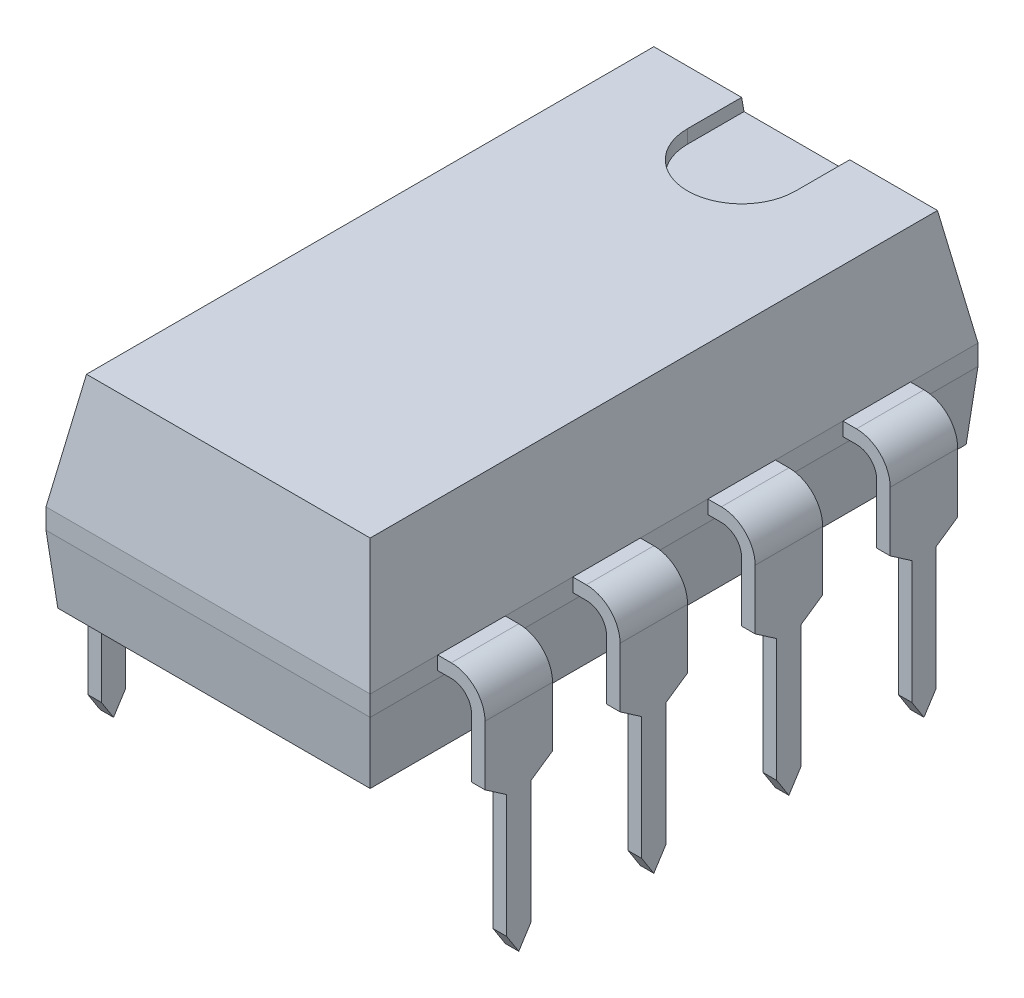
SolidWorks part; units mm, degrees
ref_plane "x/y" through (0, 0, 0) normal (0, 0, 1) x (1, 0, 0)
ref_plane "x/z" through (0, 0, 0) normal (0, 1, 0) x (1, 0, 0)
ref_plane "y/z" through (0, 0, 0) normal (1, 0, 0) x (0, 0, -1)
ref_plane "Plane1" through (0, 0.381, 0) normal (0, 1, 0) x (-1, 0, 0)
sketch "Sketch1" plane through (0, 0.381, 0) normal (0, 1, 0) x (0, 0, -1)
  line L1 (1.905, -0.762) -> (-9.525, -0.762)
  line L2 (1.905, -0.762) -> (1.905, -6.858)
  line L3 (1.905, -6.858) -> (-9.525, -6.858)
  line L4 (-9.525, -0.762) -> (-9.525, -6.858)
  dimension "D1" = 9.525
  dimension "D2" = 1.905
  dimension "D3" = 6.096
  dimension "D4" = 0.762
extrude "Base-Extrude" add sketch "Sketch1" along normal blind 3.81
ref_plane "Plane2" through (6.858, 0, 0) normal (1, 0, 0) x (0, 0, -1)
ref_plane "Plane3" through (0, 0, 9.525) normal (0, 0, 1) x (1, 0, 0)
ref_plane "Plane4" through (0.762, 0, 0) normal (1, 0, 0) x (0, 0, -1)
ref_plane "Plane5" through (0, 0, 9.525) normal (0, 0, 1) x (1, 0, 0)
chamfer "Chamfer1" distance 2.159 angle 10 4 edges at (3.81, 4.191, 9.525) (6.858, 4.191, 3.81) (3.81, 4.191, -1.905) (0.762, 4.191, 3.81)
chamfer "Chamfer2" distance 1.27 angle 5 4 edges at (6.858, 0.381, 3.81) (3.81, 0.381, 9.525) (0.762, 0.381, 3.81) (3.81, 0.381, -1.905)
sketch "Sketch2" plane through (0, 4.191, 0) normal (0, 1, 0) x (-1, 0, 0)
  line L0 (-3.81, -1.905) -> (-3.81, 3.2706) construction
  line L1 (-2.794, -2.7919) -> (-4.826, -2.7919)
  line L2 (-2.794, -2.7919) -> (-2.794, -0.5083)
  line L4 (-6.4773, -1.5243) -> (-1.1427, -1.5243) construction
  line L5 (-4.826, -2.7919) -> (-4.826, -0.5083)
  line L6 (-0.762, -1.905) -> (-6.858, -1.905) construction
  arc A0 (-2.794, -0.5083) -> (-4.826, -0.5083) centre (-3.81, -0.5083) ccw
  dimension "D2" = 2.032
  dimension "D3" = 1.016
  dimension "D1" = 1.016
  dimension "D4" = 1.016
extrude "Cut-Extrude1" cut sketch "Sketch2" against normal blind 0.254
ref_plane "Plane6" through (8.763, 0, 0) normal (1, 0, 0) x (0, 0, -1)
sketch "Sketch3" plane through (9.017, 0, 0) normal (0, 0, -1) x (-1, 0, 0)
  line L0 (9.017, 1.397) -> (9.017, -2.667)
  line L1 (8.509, 1.905) -> (6.9133, 1.905)
  line L3 (8.1439, 0.381) -> (2.2701, 0.381) construction
  arc A0 (8.509, 1.905) -> (9.017, 1.397) centre (8.509, 1.397) cw
  dimension "D2" = 1.524
  dimension "D1" = 0.508
  dimension "D3" = 4.064
extrude "Boss-Extrude-Thin1" add sketch "Sketch3" along normal mid plane 1.27 thin
sketch "Sketch4" plane through (0.127, 0, 0) normal (1, 0, 0) x (0, 0, -1)
  line L0 (-0.635, 0.2794) -> (-0.2286, 0)
  line L1 (-0.2286, 0) -> (-0.2286, -2.3095)
  line L2 (-0.2286, -2.3095) -> (0, -2.667)
  line L3 (0, 0) -> (0, -2.9486) construction
  line L4 (0.635, -2.667) -> (-0.635, -2.667) construction
  line L5 (-0.635, -2.667) -> (-0.635, 1.397) construction
  line L6 (0, -2.667) -> (-0.635, -2.667)
  line L7 (-0.635, -2.667) -> (-0.635, 0.2794)
  dimension "D1" = 2.9464
  dimension "D2" = 0.4064
extrude "Cut-Extrude2" cut sketch "Sketch4" against normal up to vertex (0.254 mm away)
sketch "Sketch5" plane through (0.127, 0, 0) normal (1, 0, 0) x (0, 0, -1)
  line L0 (0.635, -2.667) -> (0, -2.667) construction
  line L1 (0.635, -2.667) -> (0, -2.667)
  line L2 (0.635, -2.667) -> (0.635, 0.2794)
  line L3 (0.635, 0.2794) -> (0.2286, 0)
  line L4 (0.635, -2.667) -> (0.635, 1.397) construction
  line L5 (0.2286, 0) -> (0.2286, -2.3095)
  line L6 (0.2286, -2.3095) -> (0, -2.667)
  line L7 (0, -2.667) -> (-0.2286, -2.3095) construction
  line L8 (-0.2286, 0) -> (-0.635, 0.2794) construction
extrude "Cut-Extrude3" cut sketch "Sketch5" against normal up to vertex (0.254 mm away)
ref_plane "Plane9" through (3.81, 0, 0) normal (-1, 0, 0) x (0, 0, 1)
pattern_linear "LPattern1" count 4 spacing 2.54 along (0, 0, 1) of "Boss-Extrude-Thin1", "Cut-Extrude3", "Cut-Extrude2"
mirror "Mirror1" about plane through (3.81, 0, 0) normal (-1, 0, 0) of "LPattern1", "Boss-Extrude-Thin1", "Cut-Extrude2", "Cut-Extrude3"
sketch "Mounting_Plane" plane through (0, 0, 0) normal (0, 1, 0) x (1, 0, 0)
  line L36 (-0.127, -7.62) -> (0.127, -7.62) construction
  line L37 (-0.127, -5.08) -> (0.127, -5.08) construction
  line L38 (-0.127, -2.54) -> (0.127, -2.54) construction
  line L39 (7.747, -7.62) -> (7.493, -7.62) construction
  line L40 (7.747, -5.08) -> (7.493, -5.08) construction
  line L41 (7.747, -2.54) -> (7.493, -2.54) construction
  line L42 (7.747, 0) -> (7.493, 0) construction
  circle A0 centre (0, -7.62) radius 0.381
  circle A1 centre (0, -5.08) radius 0.381
  circle A2 centre (0, -2.54) radius 0.381
  circle A3 centre (0, 0) radius 0.381
  circle A4 centre (7.62, -7.62) radius 0.381
  circle A5 centre (7.62, -5.08) radius 0.381
  circle A6 centre (7.62, -2.54) radius 0.381
  circle A7 centre (7.62, 0) radius 0.381
